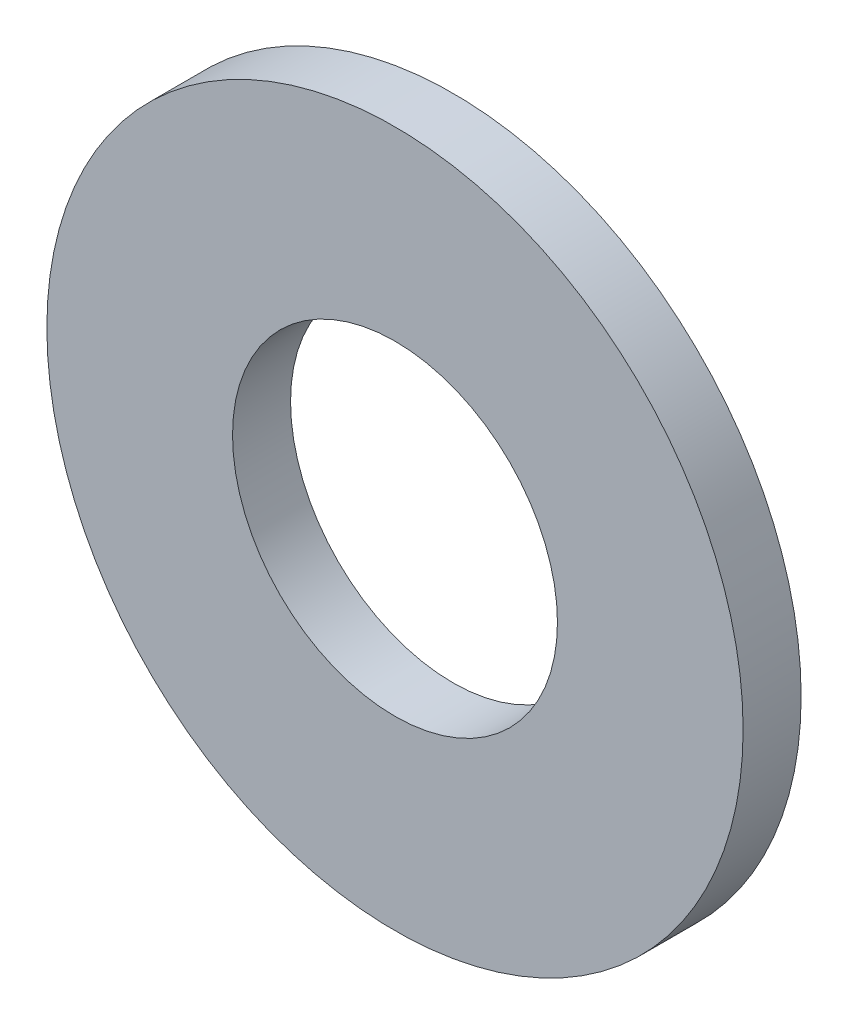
SolidWorks part; units mm, degrees
ref_plane "Plan1" through (0, 0, 0) normal (0, 0, 1) x (1, 0, 0)
ref_plane "Plan2" through (0, 0, 0) normal (0, 1, 0) x (1, 0, 0)
ref_plane "Plan3" through (0, 0, 0) normal (1, 0, 0) x (0, 0, -1)
sketch "Sketch1" plane through (0, 0, 0) normal (0, 0, 1) x (1, 0, 0)
  circle A0 centre (0, 0) radius 9
  dimension "D2" = 18
extrude "Base-Extrude" add sketch "Sketch1" along normal blind 1.5
other "Hole1"
sketch "Sketch2" plane through (0, 0, 1.5) normal (0, 0, 1) x (1, 0, 0)
  circle A0 centre (0, 0) radius 4.2
  circle A1 centre (0, 0) radius 9 construction
  dimension "D1" = 8.4
